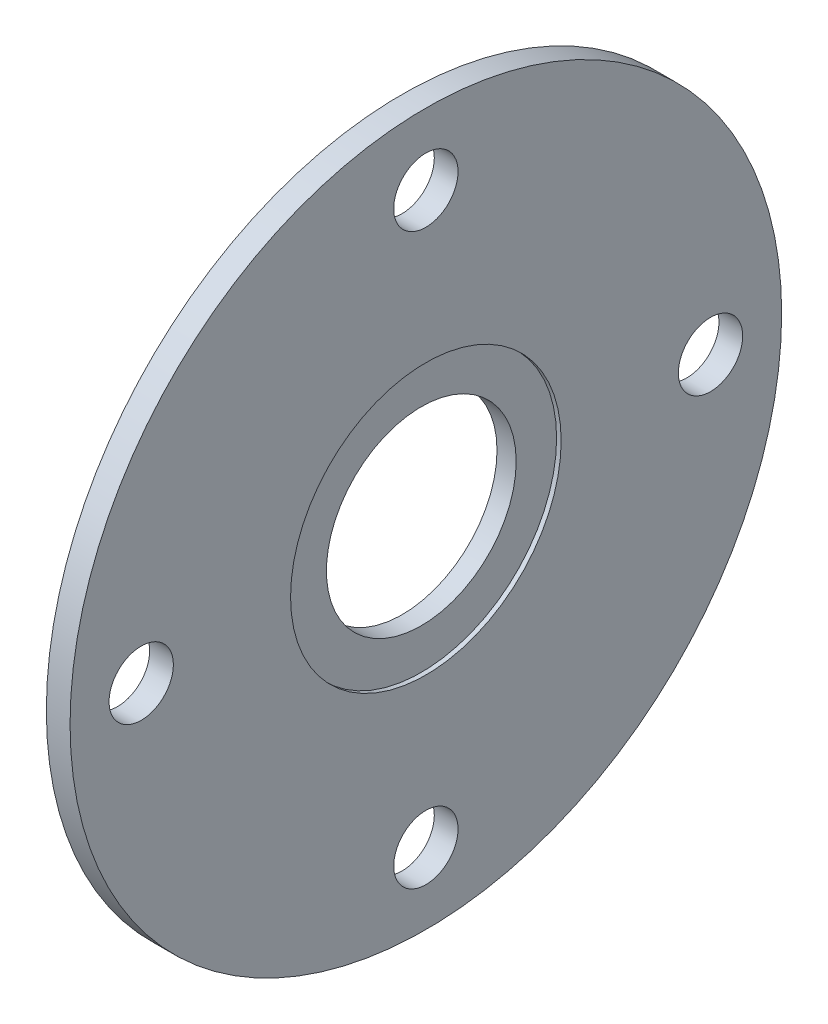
SolidWorks part; units mm, degrees
ref_plane "Front Plane" through (0, 0, 0) normal (0, 0, 1) x (1, 0, 0)
ref_plane "Top Plane" through (0, 0, 0) normal (0, 1, 0) x (1, 0, 0)
ref_plane "Right Plane" through (0, 0, 0) normal (1, 0, 0) x (0, 0, -1)
sketch "Sketch1" plane through (0, 0, 0) normal (1, 0, 0) x (0, 0, -1)
  circle A0 centre (0, 0) radius 6.35
  circle A1 centre (0, 0) radius 23.8125
  circle A2 centre (0, 19.05) radius 2.1526
  circle A3 centre (19.05, 0) radius 2.1527
  circle A4 centre (0, -19.05) radius 2.1526
  circle A5 centre (-19.05, 0) radius 2.1527
  point P15 (0, 0)
  dimension "D1" = 12.7
  dimension "D2" = 47.625
  dimension "D4" = 4.3053
  dimension "D3" = 38.1
  dimension "D5" = 4
extrude "Boss-Extrude1" add sketch "Sketch1" along normal blind 1.5875
sketch "Sketch2" plane through (1.5875, 0, 0) normal (1, 0, 0) x (0, 0, -1)
  circle A0 centre (0, 0) radius 9.0551
  dimension "D1" = 18.1102
extrude "Cut-Extrude1" cut sketch "Sketch2" against normal blind 0.3048
